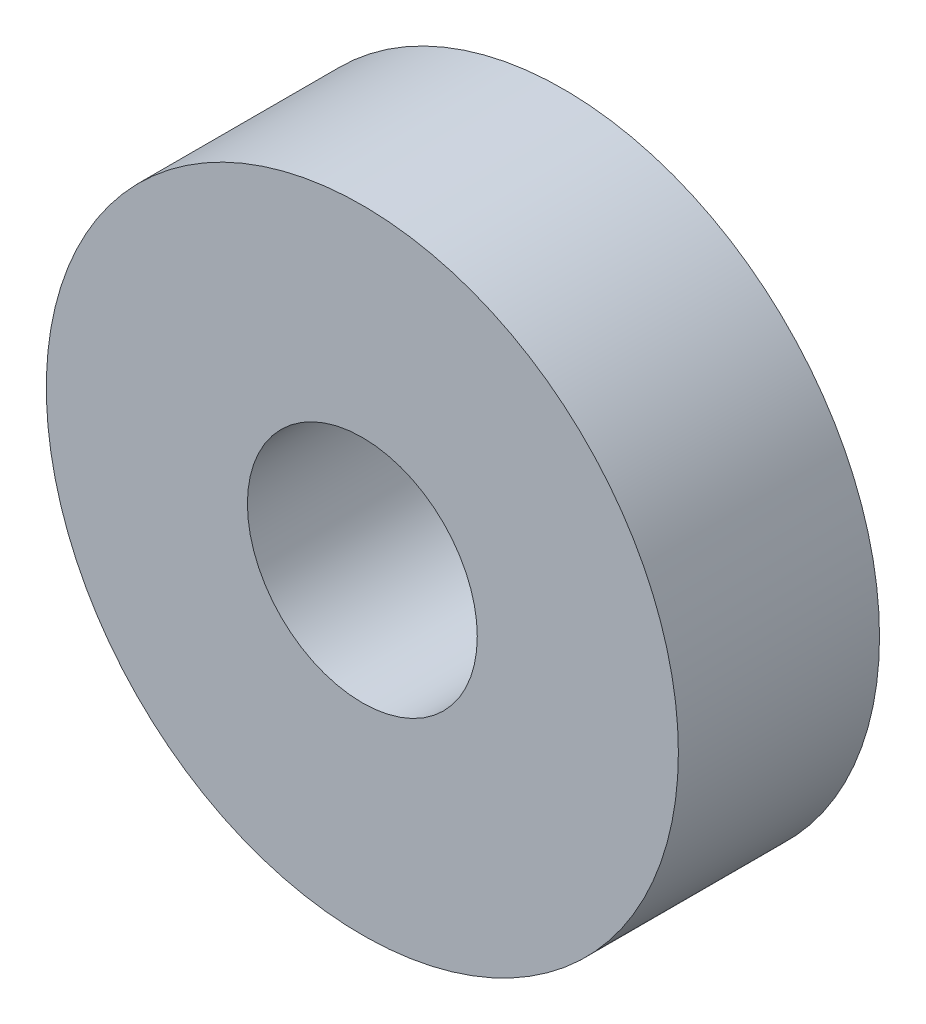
SolidWorks part; units mm, degrees
other "DetailItem1"
ref_plane "Front Plane" through (0, 0, 0) normal (0, 0, 1) x (1, 0, 0)
ref_plane "Top Plane" through (0, 0, 0) normal (0, 1, 0) x (1, 0, 0)
ref_plane "Right Plane" through (0, 0, 0) normal (1, 0, 0) x (0, 0, -1)
sketch "Sketch1" plane through (0, 0, 0) normal (0, 0, 1) x (1, 0, 0)
  circle A0 centre (0, 0) radius 4.0005
  circle A1 centre (0, 0) radius 10.9995
  dimension "D1" = 8.001
  dimension "D2" = 21.9989
extrude "Extrude1" add sketch "Sketch1" along normal blind 7.0002
